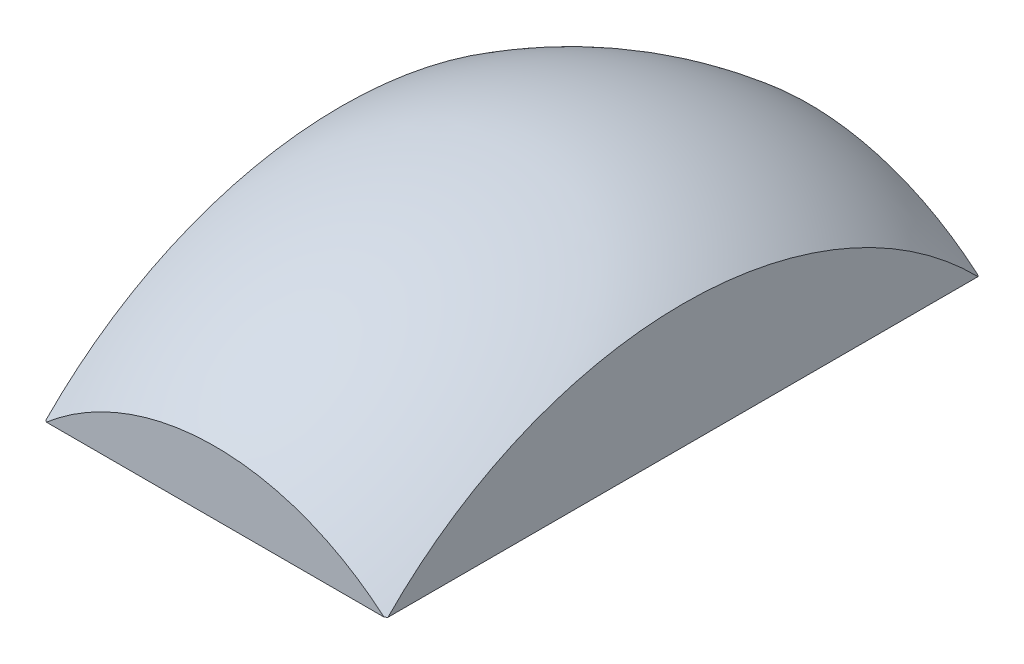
SolidWorks part; units mm, degrees
ref_plane "Front" through (0, 0, 0) normal (0, 0, 1) x (1, 0, 0)
ref_plane "Top" through (0, 0, 0) normal (0, 1, 0) x (1, 0, 0)
ref_plane "Right" through (0, 0, 0) normal (1, 0, 0) x (0, 0, -1)
sketch "Sketch1" plane through (0, 0, 0) normal (0, 0, 1) x (1, 0, 0)
  line L0 (-62.5, 65) -> (-62.5, 0)
  line L1 (-62.5, 0) -> (62.5, 0)
  line L2 (62.5, 0) -> (62.5, 65)
  line L3 (-62.5, 65) -> (62.5, 65)
  dimension "D1" = 125
  dimension "D2" = 65
extrude "Extrude1" add sketch "Sketch1" along normal mid plane 217
sketch "Sketch2" plane through (0, 0, 0) normal (1, 0, 0) x (0, 0, -1)
  line L0 (-108.5, 0) -> (-108.5, 65) construction
  line L1 (108.5, 0) -> (108.5, 65) construction
  arc A0 (-108.5, 17.7376) -> (108.5, 17.7376) centre (0, -105.6254) cw
ref_plane "Plane1" through (0, 17.7376, 108.5) normal (0, 0.6604, -0.7509) x (-1, 0, 0)
sketch "Sketch3" plane through (0, 17.7376, 108.5) normal (0, 0.6604, -0.7509) x (-1, 0, 0)
  line L0 (62.5, 35.489) -> (62.5, -13.3191) construction
  line L1 (-62.5, -13.3191) -> (-62.5, 35.489) construction
  line L2 (62.5, -13.3191) -> (79.8912, -13.3191)
  line L3 (79.8912, -13.3191) -> (79.8912, 57.0154)
  line L4 (79.8912, 57.0154) -> (-75.916, 57.0154)
  line L5 (-75.916, 57.0154) -> (-75.916, -13.3191)
  line L6 (-75.916, -13.3191) -> (-62.5, -13.3191)
  arc A0 (62.5, -13.3191) -> (-62.5, -13.3191) centre (0, -116.6056) ccw
sweep "Cut-Sweep1" cut profiles "Sketch3" path "Sketch2"
ref_plane "Plane2" through (0, 77.3502, 0) normal (0, 1, 0) x (-1, 0, 0)
sketch "Sketch4" plane through (0, 77.3502, 0) normal (0, 1, 0) x (-1, 0, 0)
  ellipse E0 centre (0, 0) end of major axis (0, -98.0251) minor radius 36.6223
